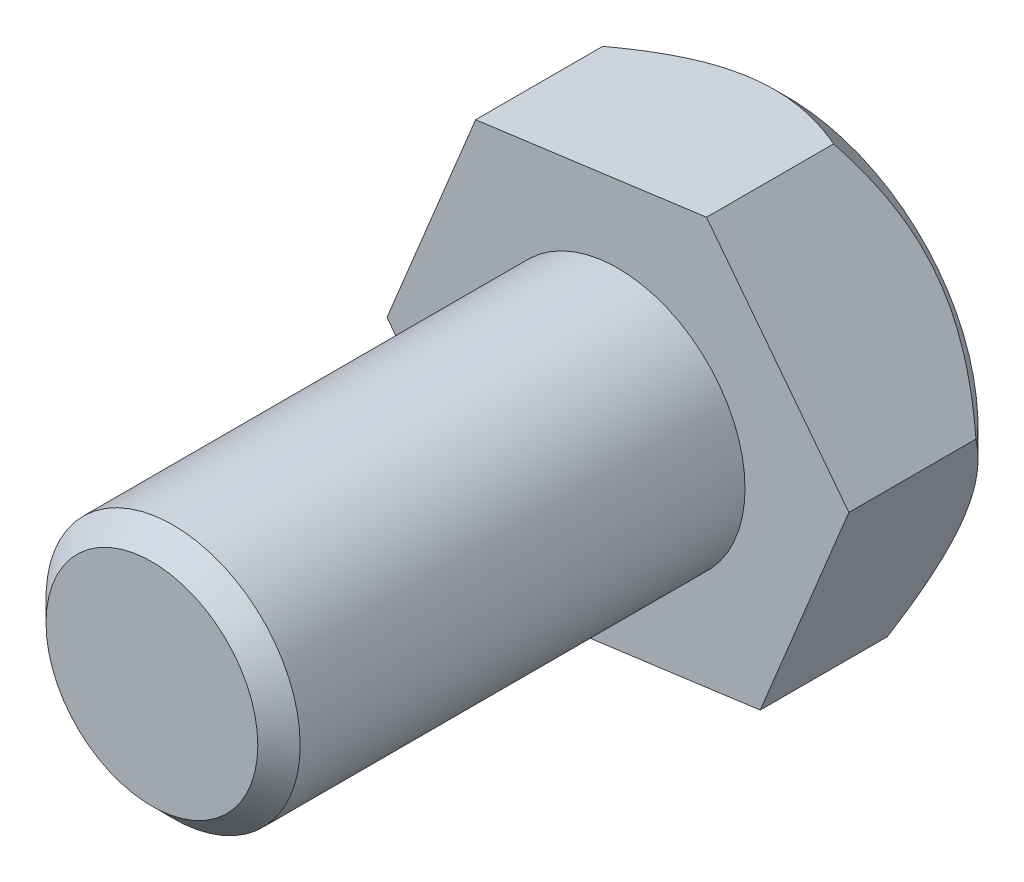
SolidWorks part; units mm, degrees
ref_plane "Plan de face" through (0, 0, 0) normal (0, 0, 1) x (1, 0, 0)
ref_plane "Plan de dessus" through (0, 0, 0) normal (0, 1, 0) x (1, 0, 0)
ref_plane "Plan de droite" through (0, 0, 0) normal (1, 0, 0) x (0, 0, -1)
sketch "Esquisse1" plane through (0, 0, 0) normal (0, 0, 1) x (1, 0, 0)
  circle A0 centre (0, 0) radius 5.5
  dimension "D1" = 11
extrude "Boss.-Extru.1" add sketch "Esquisse1" along normal blind 15
sketch "Esquisse2" plane through (0, 0, 15) normal (0, 0, 1) x (1, 0, 0)
  circle A0 centre (0, 0) radius 3
  dimension "D1" = 6
extrude "Enlèv. mat.-Extru.1" cut sketch "Esquisse2" against normal blind 11 flip side to cut
chamfer "Chanfrein1" distance 0.5 angle 45 1 edges at (3, 0, 15)
sketch "Esquisse3" plane through (0, 0, 0) normal (0, 0, -1) x (-1, 0, 0)
  line L6 (-5.4511, 0.7319) -> (-2.0917, 5.0867)
  arc A0 (-2.0917, 5.0867) -> (-5.4511, 0.7319) centre (0, 0) ccw
  point P12 (0, 0)
extrude "Enlèv. mat.-Extru.2" cut sketch "Esquisse3" against normal blind 6
chamfer "Chanfrein2" distance 1 angle 45 1 edges at (-4.3548, -3.3594, 0)
pattern_circular "Répétition circulaire1" count 6 every 60 about axis through (0, 0, 0) along (0, 0, 1) of "Enlèv. mat.-Extru.2"
